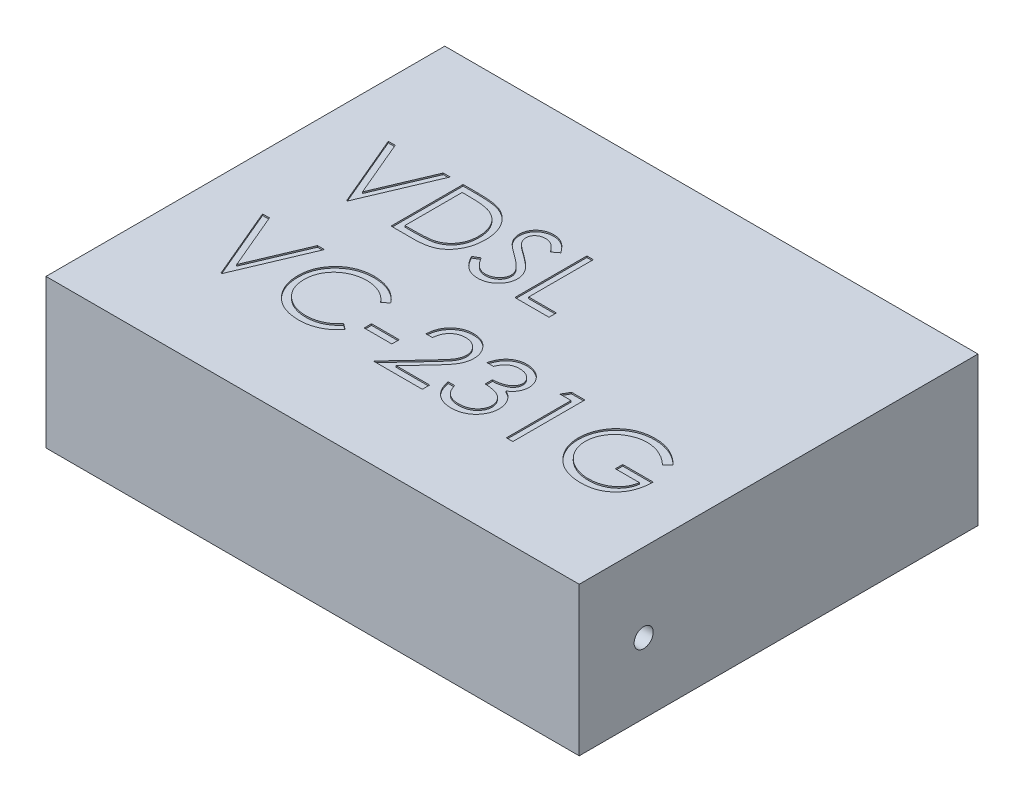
SolidWorks part; units mm, degrees
ref_plane "Front" through (0, 0, 0) normal (0, 0, 1) x (1, 0, 0)
ref_plane "Top" through (0, 0, 0) normal (0, 1, 0) x (1, 0, 0)
ref_plane "Right" through (0, 0, 0) normal (1, 0, 0) x (0, 0, -1)
sketch "Sketch1" plane through (0, 0, 0) normal (0, 1, 0) x (1, 0, 0)
  line L1 (0, 0) -> (94, 0)
  line L2 (0, 0) -> (0, 70.3)
  line L3 (0, 70.3) -> (94, 70.3)
  line L4 (94, 0) -> (94, 70.3)
  dimension "D1" = 70.3
  dimension "D2" = 94
extrude "Boss-Extrude1" add sketch "Sketch1" along normal blind 26.2
sketch "Sketch2" plane through (0, 26.2, 0) normal (0, 1, 0) x (1, 0, 0)
  line L0 (8.89, 38.1) -> (73.9683, 38.1) construction
  text T0 "VDSL  VC-231G" font "Century Gothic" height 12.7
  dimension "D1" = 38.1
  dimension "D2" = 8.89
extrude "Cut-Extrude1" cut sketch "Sketch2" against normal blind 0.254
sketch "Sketch3" plane through (0, 0, 0) normal (-1, 0, 0) x (0, 0, 1)
  line L0 (-10.9633, 10.0979) -> (-8.8109, 10.0979)
  line L1 (-19.9696, 15.6489) -> (-8.8109, 15.6489)
  line L2 (-19.9696, 15.6489) -> (-19.9696, 10.0979)
  line L3 (-19.9696, 10.0979) -> (-17.8172, 10.0979)
  line L4 (-8.8109, 15.6489) -> (-8.8109, 10.0979)
  line L6 (-17.8172, 10.0979) -> (-17.8172, 9.1839)
  line L7 (-17.8172, 9.1839) -> (-15.9479, 9.1839)
  line L8 (-10.9633, 10.0979) -> (-10.9633, 9.1839)
  line L10 (-15.9479, 9.1839) -> (-15.9479, 7.9855)
  line L11 (-15.9479, 7.9855) -> (-12.8326, 7.9855)
  line L12 (-12.8326, 9.1839) -> (-12.8326, 7.9855)
  line L13 (-12.8326, 9.1839) -> (-10.9633, 9.1839)
  line L14 (-36.3962, 15.1958) -> (-34.0738, 15.1958)
  line L15 (-42.1171, 15.1958) -> (-39.7947, 15.1958)
  line L16 (-42.1171, 15.1958) -> (-42.1171, 9.1839)
  line L17 (-42.1171, 9.1839) -> (-39.7947, 9.1839)
  line L18 (-34.0738, 15.1958) -> (-34.0738, 9.1839)
  line L20 (-39.7947, 9.1839) -> (-39.7947, 7.9855)
  line L21 (-39.7947, 7.9855) -> (-36.3962, 7.9855)
  line L22 (-36.3962, 9.1839) -> (-36.3962, 7.9855)
  line L24 (-39.7947, 15.1958) -> (-39.7947, 16.272)
  line L25 (-39.7947, 16.272) -> (-36.3962, 16.272)
  line L26 (-36.3962, 15.1958) -> (-36.3962, 16.272)
  line L27 (-36.3962, 9.1839) -> (-34.0738, 9.1839)
  dimension "D1" = 11.1587
  dimension "D2" = 6.8538
  dimension "D3" = 3.1154
extrude "Cut-Extrude2" cut sketch "Sketch3" against normal blind 2.54
sketch "Sketch4" plane through (94, 0, 0) normal (1, 0, 0) x (0, 0, -1)
  circle A0 centre (11.3598, 12.3636) radius 1.6813
  point P2 (11.3598, 12.3636)
extrude "Cut-Extrude3" cut sketch "Sketch4" against normal blind 2.54
